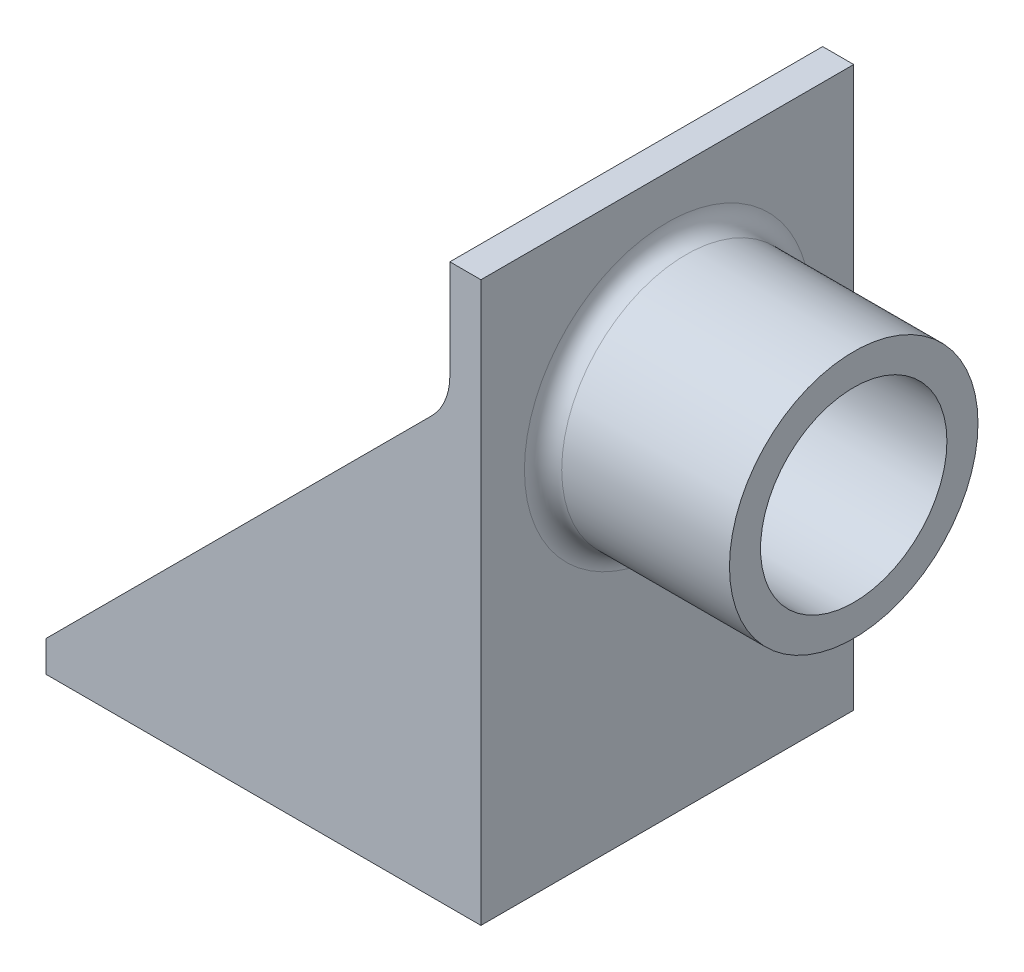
SolidWorks part; units mm, degrees
ref_plane "Front Plane" through (0, 0, 0) normal (0, 0, 1) x (1, 0, 0)
ref_plane "Top Plane" through (0, 0, 0) normal (0, 1, 0) x (1, 0, 0)
ref_plane "Right Plane" through (0, 0, 0) normal (1, 0, 0) x (0, 0, -1)
sketch "Sketch1" plane through (0, 0, 0) normal (0, 0, 1) x (1, 0, 0)
  line L0 (0, 0) -> (70, 0)
  line L1 (70, 0) -> (70, 90)
  line L2 (70, 90) -> (65, 90)
  line L3 (65, 90) -> (65, 5)
  line L4 (65, 5) -> (0, 5)
  line L5 (0, 5) -> (0, 0)
  dimension "D1" = 70
  dimension "D2" = 90
  dimension "D3" = 5
extrude "Extrude1" add sketch "Sketch1" along normal mid plane 60
fillet "Fillet1" radius 10 1 edges at (65, 5, 0)
sketch "Sketch2" plane through (0, 0, 30) normal (0, 0, 1) x (1, 0, 0)
  line L0 (65, 70) -> (0, 5)
  line L1 (65, 90) -> (65, 15) construction
  line L2 (55, 5) -> (0, 5) construction
  line L3 (0, 5) -> (0, 0) construction
  line L9 (0, 5) -> (0, 0)
  line L10 (0, 0) -> (70, 0)
  line L11 (70, 0) -> (70, 90)
  line L12 (70, 90) -> (65, 90)
  line L13 (65, 90) -> (65, 15)
  line L14 (55, 5) -> (0, 5)
  line L19 (65, 70) -> (65, 15)
  line L20 (55, 5) -> (0, 5)
  arc A1 (55, 5) -> (65, 15) centre (55, 15) ccw
  arc A2 (55, 5) -> (65, 15) centre (55, 15) ccw
  dimension "D1" = 0
extrude "Extrude2" add sketch "Sketch2" against normal blind 5
mirror "Mirror1" about plane through (0, 0, 0) normal (0, 0, 1) of "Extrude2"
fillet "Fillet2" radius 10 2 edges at (65, 70, 27.5) (65, 70, -27.5)
sketch "Sketch3" plane through (70, 0, 0) normal (1, 0, 0) x (0, 0, -1)
  line L0 (-30, 0) -> (30, 0) construction
  circle A0 centre (0, 60) radius 15
  circle A1 centre (0, 60) radius 20
  dimension "D1" = 30
  dimension "D2" = 5
  dimension "D3" = 60
extrude "Extrude3" add sketch "Sketch3" along normal blind 30
fillet "Fillet3" radius 3 1 edges at (70, 60, 20)
